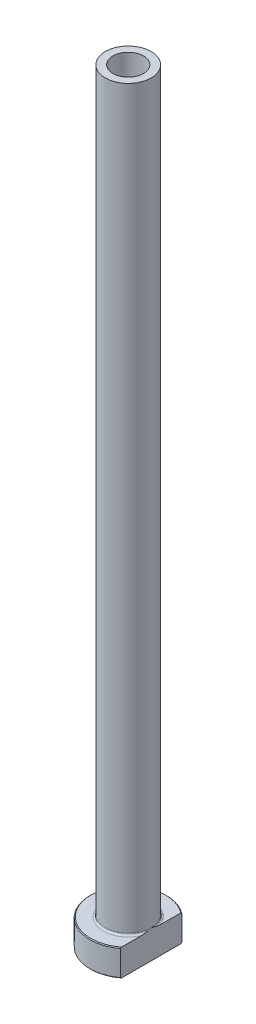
SolidWorks part; units mm, degrees
ref_plane "Front Plane" through (0, 0, 0) normal (0, 0, 1) x (1, 0, 0)
ref_plane "Top Plane" through (0, 0, 0) normal (0, 1, 0) x (1, 0, 0)
ref_plane "Right Plane" through (0, 0, 0) normal (1, 0, 0) x (0, 0, -1)
sketch "Sketch1" plane through (0, 0, 0) normal (0, 0, 1) x (1, 0, 0)
  line L0 (-4, 200) -> (-6, 200)
  line L1 (-6, 200) -> (-6, 7)
  line L2 (-6, 7) -> (-10, 7)
  line L3 (-10, 7) -> (-10, 0)
  line L4 (8.8, 0) -> (-8.8, 0) construction
  line L5 (-10, 0) -> (-4.25, 0)
  line L6 (-4, 155) -> (-4, 200)
  line L7 (0, 92.1877) -> (0, -15.5353) construction
  line L8 (0, -11) -> (0, 11) construction
  line L9 (-4, 155) -> (-4.25, 143)
  line L10 (-4.25, 143) -> (-4.25, 0)
  dimension "D1" = 0.25
  dimension "ID" = 8
  dimension "OD" = 12
  dimension "L" = 200
  dimension "H" = 20
  dimension "T" = 7
  dimension "N" = 45
  dimension "D2" = 12
  dimension "L-N" = 155
revolve "Revolve1" add sketch "Sketch1" angle 360 about L7
fillet "Fillet1" radius 0.5 1 edges at (0, 7, 6)
chamfer "Chamfer1" distance 0.2 angle 45 2 edges at (0, 7, 10) (0, 0, 10)
sketch "Sketch2" plane through (0, 0, 0) normal (0, -1, 0) x (1, 0, 0)
  line L0 (6, 8) -> (6, -8)
  circle A0 centre (0, 0) radius 10 construction
  arc A1 (6, 8) -> (6, -8) centre (0, 0) cw
  circle A2 centre (0, 0) radius 6 construction
extrude "Cut-Extrude1" cut sketch "Sketch2" against normal through all
chamfer "Chamfer2" distance 0.5 angle 45 1 edges at (0, 0, 4.25)
